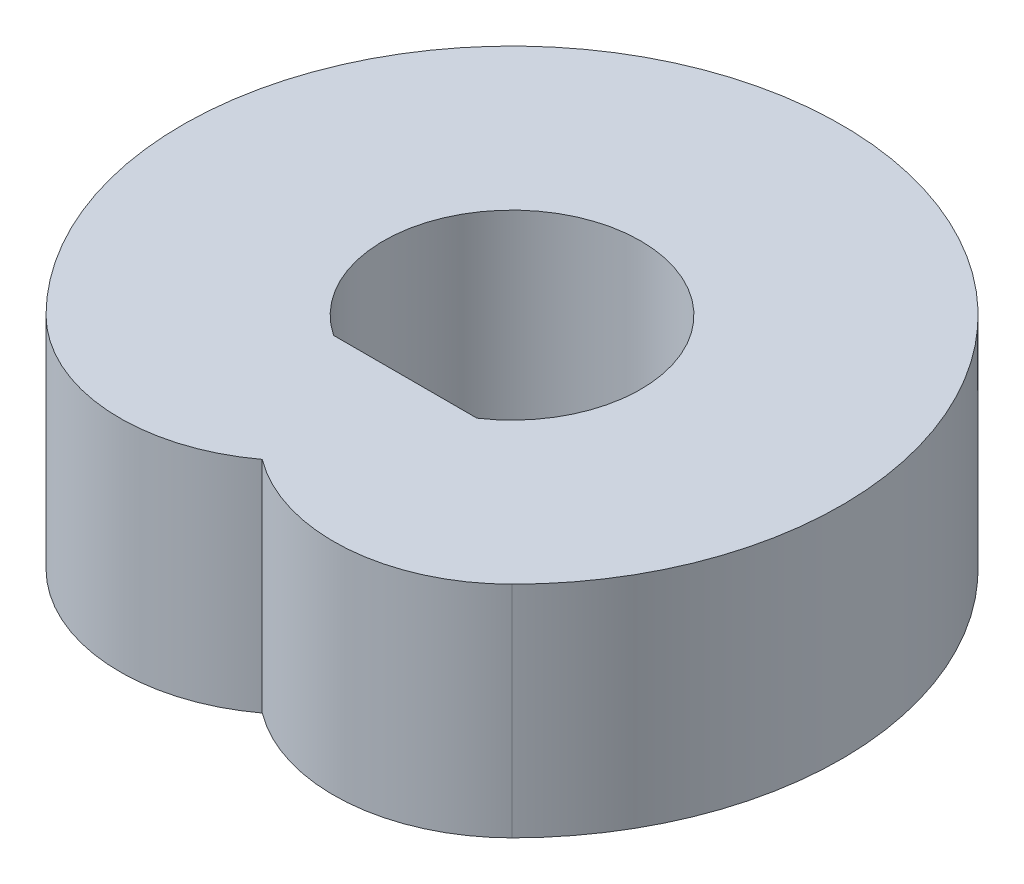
SolidWorks part; units mm, degrees
ref_plane "前视基准面" through (0, 0, 0) normal (0, 0, 1) x (1, 0, 0)
ref_plane "上视基准面" through (0, 0, 0) normal (0, 1, 0) x (1, 0, 0)
ref_plane "右视基准面" through (0, 0, 0) normal (1, 0, 0) x (0, 0, -1)
sketch "草图1" plane through (0, 0, 0) normal (0, 1, 0) x (1, 0, 0)
  line L0 (0, 0) -> (0, 825) construction
  line L1 (0, 0) -> (-424.2641, -424.2641) construction
  line L2 (0, 0) -> (424.2641, -424.2641) construction
  line L3 (0, 275) -> (229.8097, 45.1903) construction
  line L4 (0, 275) -> (-229.8097, 45.1903) construction
  line L9 (130.5456, -194.4544) -> (-130.5456, -194.4544)
  circle A0 centre (0, 0) radius 275 construction
  circle A1 centre (0, 275) radius 325 construction
  arc A2 (424.2641, -424.2641) -> (-424.2641, -424.2641) centre (0, 0) ccw
  arc A4 (-424.2641, -424.2641) -> (0, -454.8627) centre (-194.4544, -194.4544) ccw
  arc A5 (0, -454.8627) -> (424.2641, -424.2641) centre (194.4544, -194.4544) ccw
  arc A7 (130.5456, -194.4544) -> (-130.5456, -194.4544) centre (0, 0) ccw
  dimension "D1" = 550
  dimension "D2" = 650
  dimension "D4" = 135
  dimension "D3" = 600
  dimension "D8" = 135
  dimension "D5" = 135
  dimension "D6" = 135
  dimension "D7" = 135
extrude "凸台-拉伸1" add sketch "草图1" along normal blind 400
